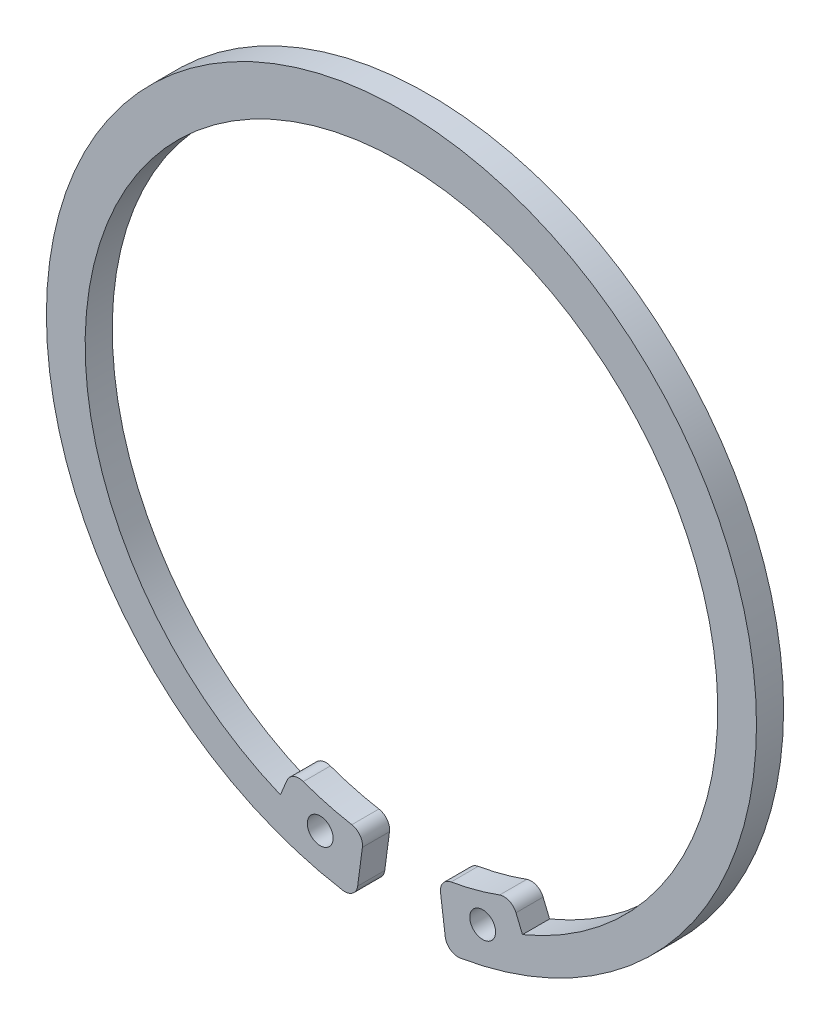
SolidWorks part; units mm, degrees
ref_plane "Plan1" through (0, 0, 0) normal (0, 0, 1) x (1, 0, 0)
ref_plane "Plan2" through (0, 0, 0) normal (0, 1, 0) x (1, 0, 0)
ref_plane "Plan3" through (0, 0, 0) normal (1, 0, 0) x (0, 0, -1)
sketch "Esquisse1" plane through (0, 0, 0) normal (0, 0, 1) x (1, 0, 0)
  line L0 (-3.1979, 24.2904) -> (1.036, -7.8693) construction
  line L1 (0, 0) -> (0, -67.082) construction
  line L2 (3.3921, -25.7655) -> (3.0259, -22.9843)
  line L3 (0, 0) -> (3.7884, -9.1459) construction
  line L4 (8.8716, -21.418) -> (9.3757, -22.635)
  line L5 (-3.3921, -25.7655) -> (-3.0259, -22.9843)
  line L6 (-8.8716, -21.418) -> (-9.3757, -22.635)
  line L7 (0, 0) -> (0, 24.5) construction
  line L8 (0, 24.5) -> (0, 28) construction
  line L9 (-3.209, -24.3749) -> (-9.3757, -22.635) construction
  arc A0 (9.3757, -22.635) -> (-9.3757, -22.635) centre (0, 0) ccw
  arc A1 (-7.6052, -20.8611) -> (-3.8443, -21.8689) centre (0, 0) ccw
  arc A2 (4.5489, -26.6212) -> (-4.5489, -26.6212) centre (0, 0.5) ccw
  arc A4 (3.8443, -21.8689) -> (7.6052, -20.8611) centre (0, 0) ccw
  arc A5 (7.6052, -20.8611) -> (8.8716, -21.418) centre (7.9477, -21.8007) cw
  arc A6 (3.0259, -22.9843) -> (3.8443, -21.8689) centre (4.0174, -22.8538) cw
  arc A7 (-3.0259, -22.9843) -> (-3.8443, -21.8689) centre (-4.0174, -22.8538) ccw
  arc A8 (-8.8716, -21.418) -> (-7.6052, -20.8611) centre (-7.9477, -21.8007) cw
  arc A9 (-4.5489, -26.6212) -> (-3.3921, -25.7655) centre (-4.3835, -25.6349) ccw
  arc A10 (4.5489, -26.6212) -> (3.3921, -25.7655) centre (4.3835, -25.6349) cw
  circle A11 centre (-6.2924, -23.505) radius 1
  circle A12 centre (6.2924, -23.505) radius 1
  point P19 (8.4972, -20.514)
  point P22 (2.8982, -22.0142)
  point P25 (-2.8982, -22.0142)
  point P30 (-8.4972, -20.514)
  point P33 (-3.5248, -26.7732)
  point P36 (3.5248, -26.7732)
  dimension "D1" = 27.5
  dimension "D2" = 4.8
  dimension "D3" = 3.5
  dimension "D6" = 1
  dimension "D4" = 0.5
  dimension "D7" = 2
  dimension "a" = 7.5
  dimension "D5" = 15
extrude "Base-Extrusion" add sketch "Esquisse1" along normal blind 2.1
equation "\"D5@Esquisse1\"=\"a@Esquisse1\"*2"
equation "\"D6@Esquisse1\"=\"D7@Esquisse1\"/2"
equation "\"D4@Esquisse1\" = \"D6@Esquisse1\"/2"
